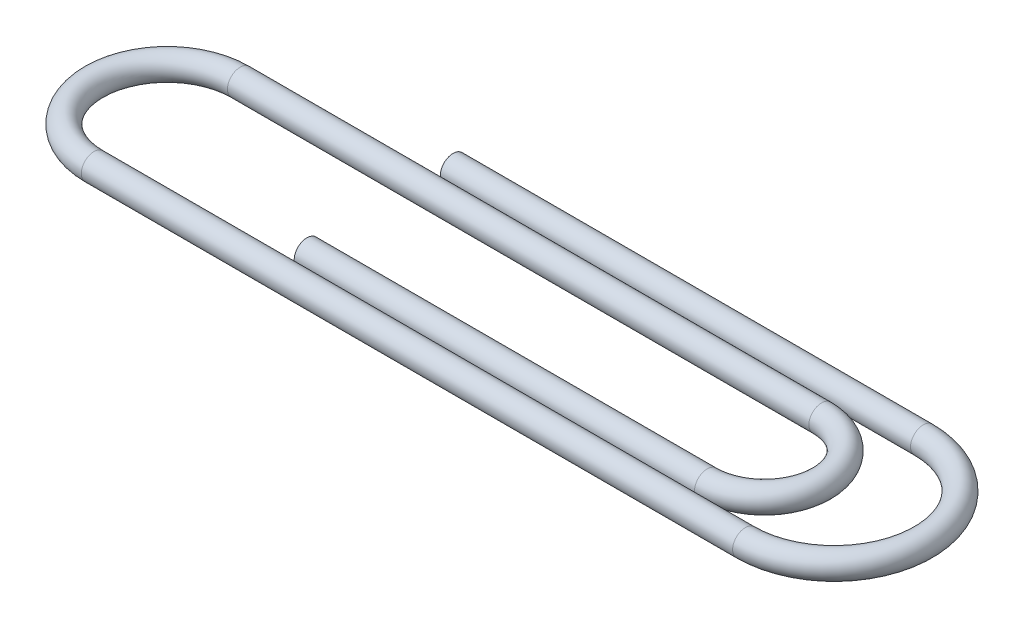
SolidWorks part; units mm, degrees
ref_plane "Front" through (0, 0, 0) normal (0, 0, 1) x (1, 0, 0)
ref_plane "Top" through (0, 0, 0) normal (0, 1, 0) x (1, 0, 0)
ref_plane "Right" through (0, 0, 0) normal (1, 0, 0) x (0, 0, -1)
sketch "Sketch1" plane through (0, 0, 0) normal (0, 1, 0) x (1, 0, 0)
  line L0 (0, 0) -> (15.75, 0)
  line L1 (15.75, 4.5) -> (-7.125, 4.5)
  line L2 (-7.125, -1.25) -> (18.5, -1.25)
  line L3 (18.5, 5.75) -> (0, 5.75)
  arc A0 (15.75, 0) -> (15.75, 4.5) centre (15.75, 2.25) ccw
  arc A1 (-7.125, 4.5) -> (-7.125, -1.25) centre (-7.125, 1.625) ccw
  arc A2 (18.5, -1.25) -> (18.5, 5.75) centre (18.5, 2.25) ccw
  dimension "D3" = 3.5
  dimension "D4" = 4
  dimension "D6" = 32
  dimension "D5" = 10
sketch "Sketch2" plane through (0, 0, 0) normal (1, 0, 0) x (0, 0, -1)
  circle A0 centre (0, 0) radius 0.5
  dimension "D1" = 1
sweep "Base-Sweep" add profiles "Sketch2" path "Sketch1"
